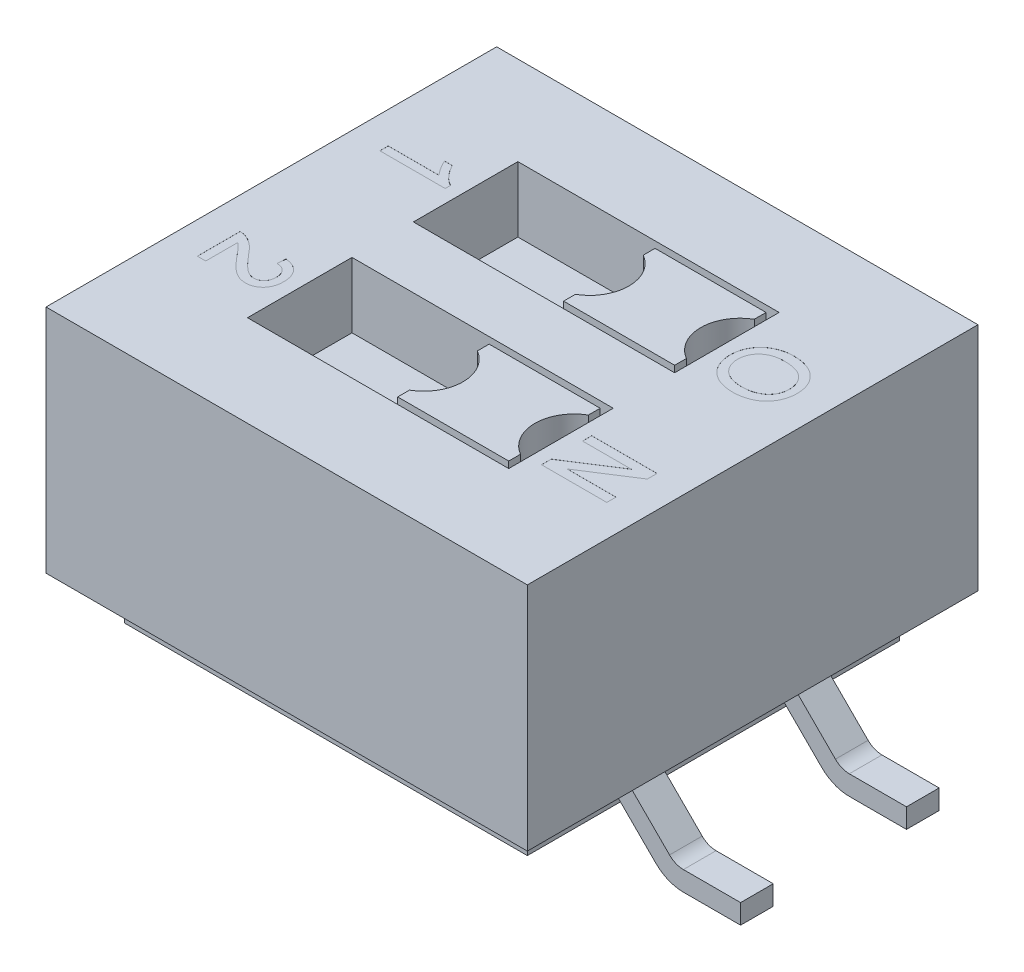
SolidWorks part; units mm, degrees
ref_plane "Front" through (0, 0, 0) normal (0, 0, 1) x (1, 0, 0)
ref_plane "Top" through (0, 0, 0) normal (0, 1, 0) x (1, 0, 0)
ref_plane "Right" through (0, 0, 0) normal (1, 0, 0) x (0, 0, -1)
sketch "Эскиз1" plane through (0, 0, 0) normal (0, 0, 1) x (1, 0, 0)
  line L0 (-0.5, 0) -> (0.3757, 0)
  line L1 (0.8, 0.1757) -> (1.5364, 0.9121)
  line L2 (1.7485, 1) -> (7.2515, 1)
  line L3 (4.5, 1) -> (4.5, -2.4142) construction
  line L4 (8.2, 0.1757) -> (7.4636, 0.9121)
  line L5 (9.5, 0) -> (8.6243, 0)
  line L6 (-0.5, 0.3) -> (0.3757, 0.3)
  line L7 (0.5879, 0.3879) -> (1.3243, 1.1243)
  line L8 (1.7485, 1.3) -> (7.2515, 1.3)
  line L9 (8.4121, 0.3879) -> (7.6757, 1.1243)
  line L10 (9.5, 0.3) -> (8.6243, 0.3)
  line L11 (-0.5, 0) -> (-0.5, 0.3)
  line L12 (9.5, 0) -> (9.5, 0.3)
  line L13 (-0.5, 0.3) -> (0.5, 0.3) construction
  line L14 (0.5, 0.3) -> (1.5, 1.3) construction
  line L15 (0.6243, 0) -> (1.6243, 1) construction
  line L16 (1.6243, 1) -> (7.3757, 1) construction
  line L17 (8.3757, 0) -> (7.3757, 1) construction
  line L18 (8.5, 0.3) -> (7.5, 1.3) construction
  line L19 (9.5, 0.3) -> (8.5, 0.3) construction
  line L20 (-0.5, 0) -> (0.6243, 0) construction
  line L21 (1.5, 1.3) -> (7.5, 1.3) construction
  line L22 (9.5, 0) -> (8.3757, 0) construction
  arc A0 (0.3757, 0.3) -> (0.5879, 0.3879) centre (0.3757, 0.6) ccw
  arc A1 (1.5364, 0.9121) -> (1.7485, 1) centre (1.7485, 0.7) cw
  arc A2 (7.4636, 0.9121) -> (7.2515, 1) centre (7.2515, 0.7) ccw
  arc A3 (8.4121, 0.3879) -> (8.6243, 0.3) centre (8.6243, 0.6) ccw
  arc A4 (0.3757, 0) -> (0.8, 0.1757) centre (0.3757, 0.6) ccw
  arc A5 (1.3243, 1.1243) -> (1.7485, 1.3) centre (1.7485, 0.7) cw
  arc A6 (7.2515, 1.3) -> (7.6757, 1.1243) centre (7.2515, 0.7) cw
  arc A7 (8.2, 0.1757) -> (8.6243, 0) centre (8.6243, 0.6) ccw
  point P20 (1.6243, 1)
  dimension "D1" = 0.3
  dimension "D2" = 1
  dimension "D7" = 0.3
  dimension "D8" = 0.6
  dimension "D4" = 10
  dimension "D5" = 0.5
  dimension "D6" = 45
  dimension "D3" = 0.8757
extrude "Вытянуть1" add sketch "Эскиз1" along normal mid plane 0.5
ref_plane "Плоскость1" through (0, 4.83, 0) normal (0, 1, 0) x (-1, 0, 0)
sketch "Эскиз2" plane through (0, 4.83, 0) normal (0, 1, 0) x (-1, 0, 0)
  line L0 (-4.5, -0.25) -> (-4.5, 4.1809) construction
  line L1 (-0.815, -2.16) -> (-8.185, -2.16)
  line L2 (-0.815, -2.16) -> (-0.815, 4.74)
  line L3 (-0.815, 4.74) -> (-8.185, 4.74)
  line L4 (-8.185, -2.16) -> (-8.185, 4.74)
  line L5 (-7.2515, -0.25) -> (-1.7485, -0.25) construction
  dimension "D1" = 2.16
  dimension "D2" = 6.9
  dimension "D3" = 7.37
extrude "Вытянуть2" add sketch "Эскиз2" against normal up to surface (3.53 mm away)
sketch "Эскиз4" plane through (0, 4.83, 0) normal (0, 1, 0) x (-1, 0, 0)
  line L0 (-4.7, -0.7) -> (-6.4, -0.7)
  line L1 (-2.5, -0.8) -> (-6.5, -0.8)
  line L2 (-2.5, -0.8) -> (-2.5, 0.8)
  line L3 (-2.5, 0.8) -> (-6.5, 0.8)
  line L4 (-6.5, -0.8) -> (-6.5, 0.8)
  line L5 (-6.4, -0.7) -> (-6.4, -0.5196)
  line L6 (-4.7, 0.7) -> (-6.4, 0.7)
  line L7 (-4.7, 0.7) -> (-4.7, 0.5196)
  line L8 (0, 0) -> (-4.5, 0) construction
  line L9 (-4.5, 0) -> (-4.5, -2.16) construction
  line L10 (-8.185, -2.16) -> (-0.815, -2.16) construction
  line L11 (-2.5, -0.7) -> (-6.4, -0.7) construction
  line L12 (-2.5, 0.7) -> (-6.4, 0.7) construction
  line L13 (-4.7, -0.5196) -> (-4.7, -0.7)
  line L14 (-6.4, 0.5196) -> (-6.4, 0.7)
  line L15 (-6.4, -0.7) -> (-6.4, 0.7) construction
  arc A0 (-6.4, -0.5196) -> (-6.4, 0.5196) centre (-6.7, 0) ccw
  arc A2 (-4.7, 0.5196) -> (-4.7, -0.5196) centre (-4.4, 0) ccw
  dimension "D6" = 0.6
  dimension "D2" = 4
  dimension "D3" = 1.6
  dimension "D4" = 1.7
  dimension "D5" = 0.1
  dimension "D1" = 0.1
extrude "Вырез-Вытянуть1" cut sketch "Эскиз4" against normal blind 1
sketch "Эскиз5"
  dimension "D1" = 3.2
  dimension "D2" = 2.2
  dimension "D3" = 0.4
extrude "Вырез-Вытянуть2" cut sketch "Эскиз5" against normal blind 0.001
pattern_linear "Линейный массив1" count 2 spacing 2.54 along (0, 0, 1) of "Вытянуть1"
sketch "Эскиз3" plane through (0, 1.3, 0) normal (0, -1, 0) x (1, 0, 0)
  line L0 (0.815, 1.29) -> (8.185, 1.29) construction
  line L1 (1.415, 4.14) -> (7.585, 4.14)
  line L2 (1.415, 4.14) -> (1.415, -1.56)
  line L3 (1.415, -1.56) -> (7.585, -1.56)
  line L4 (7.585, 4.14) -> (7.585, -1.56)
  line L5 (0.815, -2.16) -> (0.815, 4.74) construction
  line L6 (8.185, 4.74) -> (8.185, -2.16) construction
  line L7 (4.5, 4.74) -> (4.5, -2.16) construction
  line L8 (0.815, 4.74) -> (8.185, 4.74) construction
  line L9 (8.185, -2.16) -> (0.815, -2.16) construction
  dimension "D1" = 0.6
  dimension "D2" = 0.6
extrude "Вытянуть3" add sketch "Эскиз3" along normal offset from surface (0.66 mm away) 4.19
pattern_linear "Линейный массив2" count 2 spacing 2.54 along (0, 0, 1) of "Вырез-Вытянуть1"
